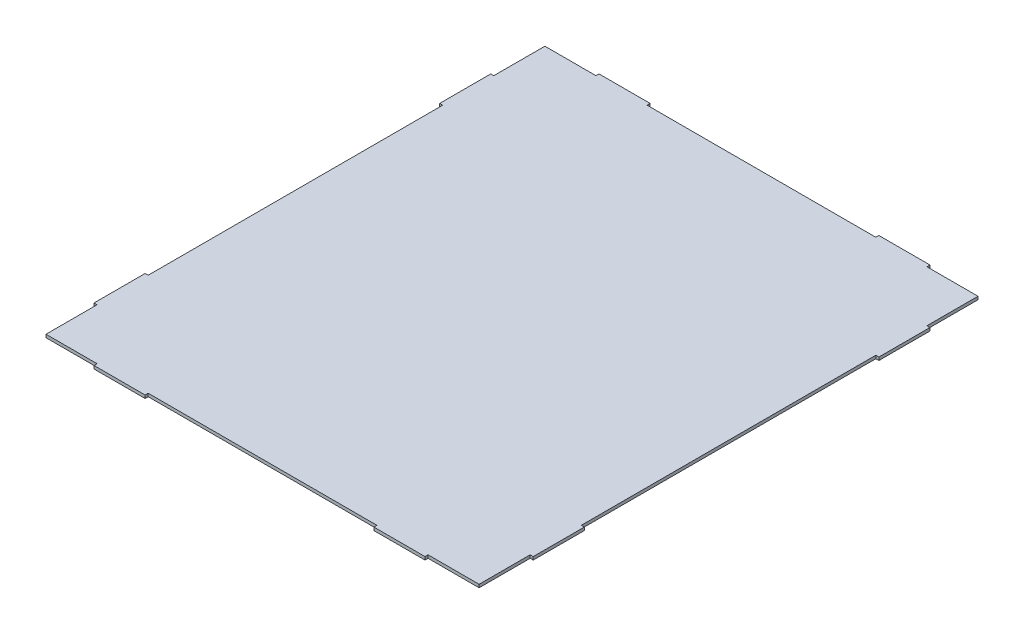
SolidWorks part; units mm, degrees
ref_plane "Front Plane" through (0, 0, 0) normal (0, 0, 1) x (1, 0, 0)
ref_plane "Top Plane" through (0, 0, 0) normal (0, 1, 0) x (1, 0, 0)
ref_plane "Right Plane" through (0, 0, 0) normal (1, 0, 0) x (0, 0, -1)
sketch "Sketch1" plane through (0, 0, 0) normal (0, 1, 0) x (1, 0, 0)
  line L0 (-95.9263, 244.2) -> (575.2485, 244.2) construction
  line L1 (0, 0) -> (50, 0)
  line L2 (0, 0) -> (0, 50)
  line L3 (0, 488.4) -> (50, 488.4)
  line L4 (424, 0) -> (424, 50)
  line L5 (-3, 438.4) -> (0, 438.4)
  line L6 (-3, 438.4) -> (-3, 388.4)
  line L7 (-3, 388.4) -> (0, 388.4)
  line L9 (-3, 100) -> (0, 100)
  line L10 (-3, 100) -> (-3, 50)
  line L11 (-3, 50) -> (0, 50)
  line L13 (212, 648.4089) -> (212, -80.169) construction
  line L14 (0, 438.4) -> (0, 488.4)
  line L15 (0, 100) -> (0, 388.4)
  line L16 (427, 100) -> (427, 50)
  line L17 (427, 100) -> (424, 100)
  line L18 (427, 388.4) -> (424, 388.4)
  line L19 (427, 438.4) -> (427, 388.4)
  line L20 (427, 438.4) -> (424, 438.4)
  line L21 (424, 50) -> (427, 50)
  line L22 (424, 438.4) -> (424, 488.4)
  line L23 (424, 100) -> (424, 388.4)
  line L24 (374, 488.4) -> (424, 488.4)
  line L26 (50, 488.4) -> (50, 491.4)
  line L27 (50, 491.4) -> (100, 491.4)
  line L28 (100, 488.4) -> (100, 491.4)
  line L30 (324, 488.4) -> (324, 491.4)
  line L31 (324, 491.4) -> (374, 491.4)
  line L32 (374, 488.4) -> (374, 491.4)
  line L33 (100, 488.4) -> (324, 488.4)
  line L34 (374, 0) -> (374, -3)
  line L35 (324, 0) -> (324, -3)
  line L36 (324, -3) -> (374, -3)
  line L37 (100, 0) -> (100, -3)
  line L38 (50, 0) -> (50, -3)
  line L39 (50, -3) -> (100, -3)
  line L40 (100, 0) -> (324, 0)
  line L41 (374, 0) -> (424, 0)
  dimension "D1" = 488.4
  dimension "D2" = 424
  dimension "D3" = 50
  dimension "D4" = 3
  dimension "D5" = 50
  dimension "D6" = 50
  dimension "D7" = 50
  dimension "D8" = 3
  dimension "D9" = 50
  dimension "D10" = 50
  dimension "D11" = 3
  dimension "D12" = 3
  dimension "D13" = 50
  dimension "D14" = 50
extrude "Boss-Extrude1" add sketch "Sketch1" along normal blind 3
